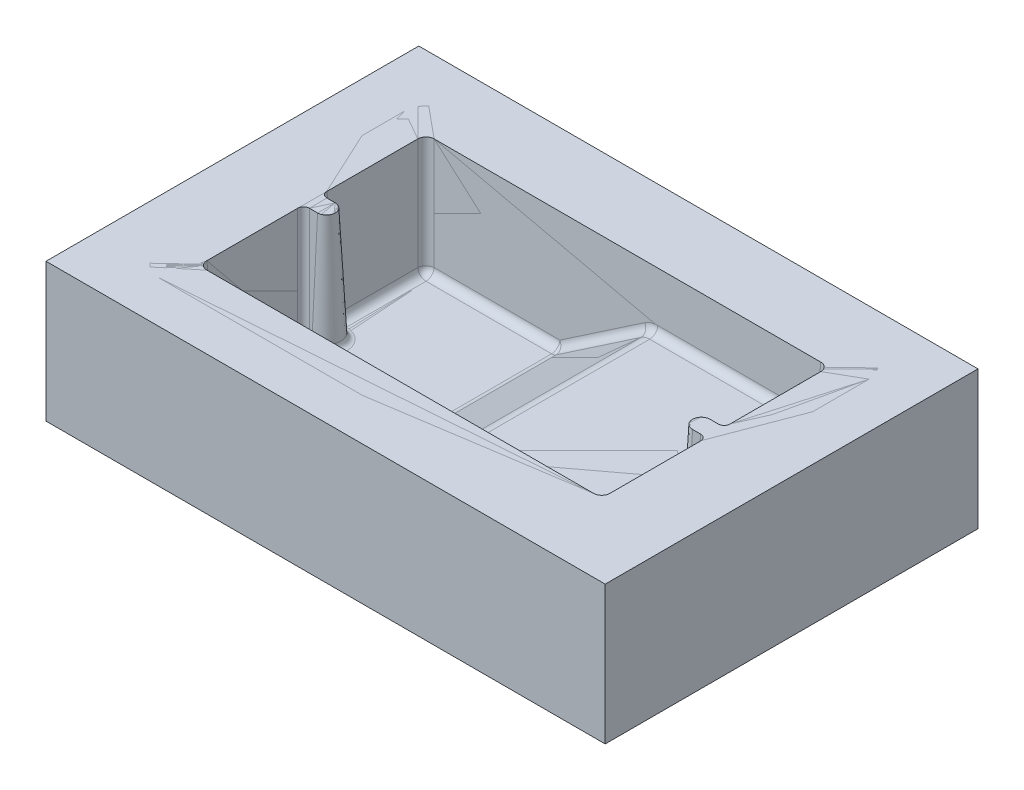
SolidWorks part; units mm, degrees
ref_plane "Front Plane" through (0, 0, 0) normal (0, 0, 1) x (1, 0, 0)
ref_plane "Top Plane" through (0, 0, 0) normal (0, 1, 0) x (1, 0, 0)
ref_plane "Right Plane" through (0, 0, 0) normal (1, 0, 0) x (0, 0, -1)
surface "Surface-Radiate1" parameters "D1"=9
surface "Surface-Knit4"
ref_plane "Plane1" through (0, -75.8143, 0) normal (0, 1, 0) x (1, 0, 0)
sketch "Sketch2" plane through (0, -75.8143, 0) normal (0, 1, 0) x (1, 0, 0)
  line L0 (219.7334, -115.5) -> (219.7334, 115.5) construction
  line L1 (-196.2666, -135.5) -> (199.7334, -135.5) construction
  line L2 (-216.2666, 115.5) -> (-216.2666, -115.5) construction
  line L3 (199.7334, 135.5) -> (-196.2666, 135.5) construction
  line L4 (219.7334, -115.5) -> (219.7334, 115.5)
  line L5 (-196.2666, -135.5) -> (199.7334, -135.5)
  line L6 (-216.2666, 115.5) -> (-216.2666, -115.5)
  line L7 (199.7334, 135.5) -> (-196.2666, 135.5)
  line L8 (-196.2666, -130.5) -> (199.7334, -130.5) construction
  line L9 (214.7334, -115.5) -> (214.7334, 115.5) construction
  line L10 (199.7334, 130.5) -> (-196.2666, 130.5) construction
  line L11 (-211.2666, 115.5) -> (-211.2666, -115.5) construction
  arc A0 (219.7334, 115.5) -> (199.7334, 135.5) centre (199.7334, 115.5) ccw construction
  arc A1 (199.7334, -135.5) -> (219.7334, -115.5) centre (199.7334, -115.5) ccw construction
  arc A2 (-216.2666, -115.5) -> (-196.2666, -135.5) centre (-196.2666, -115.5) ccw construction
  arc A3 (-196.2666, 135.5) -> (-216.2666, 115.5) centre (-196.2666, 115.5) ccw construction
  arc A4 (219.7334, 115.5) -> (199.7334, 135.5) centre (199.7334, 115.5) ccw
  arc A5 (199.7334, -135.5) -> (219.7334, -115.5) centre (199.7334, -115.5) ccw
  arc A6 (-216.2666, -115.5) -> (-196.2666, -135.5) centre (-196.2666, -115.5) ccw
  arc A7 (-196.2666, 135.5) -> (-216.2666, 115.5) centre (-196.2666, 115.5) ccw
  arc A8 (199.7334, -130.5) -> (214.7334, -115.5) centre (199.7334, -115.5) ccw construction
  arc A9 (214.7334, 115.5) -> (199.7334, 130.5) centre (199.7334, 115.5) ccw construction
  arc A10 (-196.2666, 130.5) -> (-211.2666, 115.5) centre (-196.2666, 115.5) ccw construction
  arc A11 (-211.2666, -115.5) -> (-196.2666, -130.5) centre (-196.2666, -115.5) ccw construction
  dimension "D1" = 5
extrude "Boss-Extrude2" add sketch "Sketch2" along normal up to surface (130 mm away)
sketch "Sketch3" plane through (0, -75.8143, 0) normal (0, -1, 0) x (1, 0, 0)
  line L1 (-262.5, 175) -> (262.5, 175)
  line L2 (-262.5, 175) -> (-262.5, -175)
  line L3 (-262.5, -175) -> (262.5, -175)
  line L4 (262.5, 175) -> (262.5, -175)
  line L5 (-262.5, 175) -> (262.5, -175) construction
  line L6 (-262.5, -175) -> (262.5, 175) construction
  point P0 (0, 0)
  dimension "D1" = 525
  dimension "D2" = 350
extrude "Boss-Extrude4" add sketch "Sketch3" against normal blind 130 contours L4 L1 L2 L3 M5 M12 M11 M10 M9 M8 M7 M6
